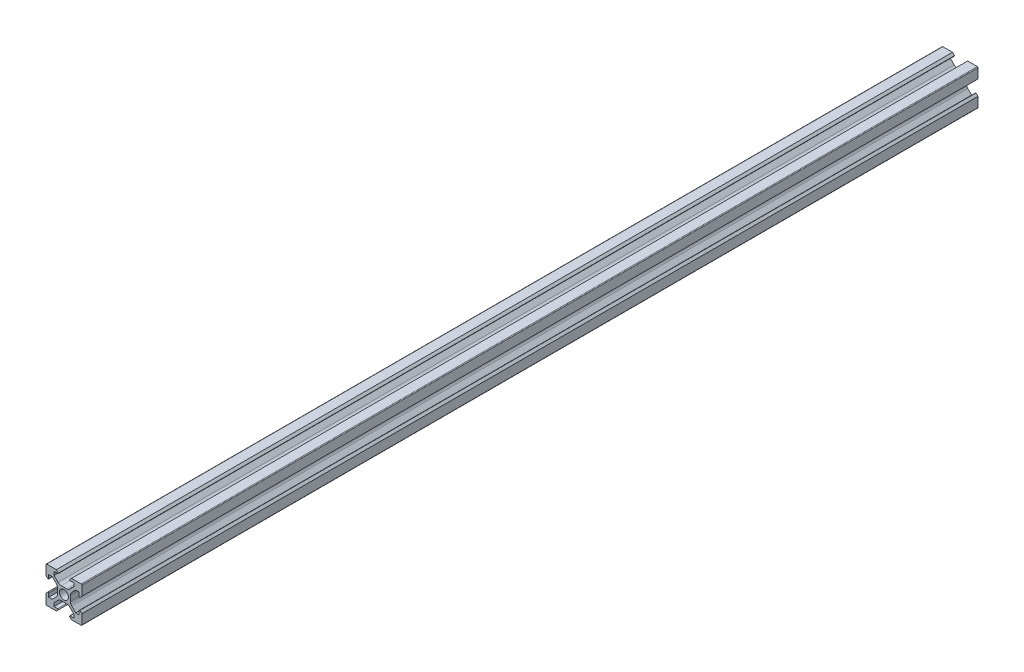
SolidWorks part; units mm, degrees
ref_plane "Plano frontal" through (0, 0, 0) normal (0, 0, 1) x (1, 0, 0)
ref_plane "Plano superior" through (0, 0, 0) normal (0, 1, 0) x (1, 0, 0)
ref_plane "Plano direito" through (0, 0, 0) normal (1, 0, 0) x (0, 0, -1)
sketch "Esboço1" plane through (0, 0, 0) normal (0, 0, 1) x (1, 0, 0)
  line L0 (-3.1, 8.9) -> (-4.2, 10)
  line L1 (-9.6, 10) -> (-4.2, 10)
  line L2 (-3.6, 1.5038) -> (-3.6, 0)
  line L3 (-8.5, 5.5) -> (-8.5, 3.5)
  line L4 (-6.5607, 5.5) -> (-4.3322, 3.2716)
  line L5 (-8.5, 5.5) -> (-6.5607, 5.5)
  line L6 (-10, 9.6) -> (-10, 4.2)
  line L7 (-8.9, 3.1) -> (-10, 4.2)
  line L8 (0, 3.6) -> (0, -3.6) construction
  line L9 (9.8828, -9.8828) -> (0, 0) construction
  line L10 (9.8828, 9.8828) -> (0, 0) construction
  line L11 (3.6, -1.5038) -> (3.6, 0)
  line L12 (8.5, -5.5) -> (8.5, -3.5)
  line L13 (-5.5, 8.5) -> (-5.5, 6.5607)
  line L14 (6.5607, -5.5) -> (4.3322, -3.2716)
  line L15 (8.5, -5.5) -> (6.5607, -5.5)
  line L16 (3.1, -8.9) -> (4.2, -10)
  line L17 (9.6, -10) -> (4.2, -10)
  line L18 (5.5, -8.5) -> (5.5, -6.5607)
  line L19 (-18.5, 8.5) -> (-18.5, -8.5) construction
  line L20 (5.5, -6.5607) -> (3.2716, -4.3322)
  line L21 (5.5, -8.5) -> (3.5, -8.5)
  line L22 (10, -9.6) -> (10, -4.2)
  line L23 (-9.8828, 9.8828) -> (0, 0) construction
  line L24 (8.9, -3.1) -> (10, -4.2)
  line L25 (-5.5, 6.5607) -> (-3.2716, 4.3322)
  line L26 (5.5, 8.5) -> (3.5, 8.5)
  line L27 (-20, 10) -> (-20, -10) construction
  line L28 (5.5, 6.5607) -> (3.2716, 4.3322)
  line L29 (5.5, 8.5) -> (5.5, 6.5607)
  line L30 (8.9, 3.1) -> (10, 4.2)
  line L31 (10, 9.6) -> (10, 4.2)
  line L32 (8.5, 5.5) -> (6.5607, 5.5)
  line L33 (-5.5, 8.5) -> (-3.5, 8.5)
  line L34 (6.5607, 5.5) -> (4.3322, 3.2716)
  line L35 (8.5, 5.5) -> (8.5, 3.5)
  line L36 (-20, 10) -> (0, 10) construction
  line L37 (3.6, 1.5038) -> (3.6, 0)
  line L38 (9.6, 10) -> (4.2, 10)
  line L39 (-18.5, 8.5) -> (-1.5, 8.5) construction
  line L40 (-1.5038, 3.6) -> (1.5038, 3.6)
  line L41 (3.1, 8.9) -> (4.2, 10)
  line L42 (-8.9, -3.1) -> (-10, -4.2)
  line L43 (-10, -9.6) -> (-10, -4.2)
  line L44 (-1.5038, -3.6) -> (1.5038, -3.6)
  line L45 (-5.5, -8.5) -> (-3.5, -8.5)
  line L46 (-5.5, -6.5607) -> (-3.2716, -4.3322)
  line L47 (-5.5, -8.5) -> (-5.5, -6.5607)
  line L48 (-9.6, -10) -> (-4.2, -10)
  line L49 (-3.1, -8.9) -> (-4.2, -10)
  line L50 (-8.5, -5.5) -> (-6.5607, -5.5)
  line L51 (-6.5607, -5.5) -> (-4.3322, -3.2716)
  line L52 (-8.5, -5.5) -> (-8.5, -3.5)
  line L53 (-3.6, -1.5038) -> (-3.6, 0)
  line L54 (0, 10) -> (0, -10) construction
  line L55 (-20, -10) -> (0, -10) construction
  line L56 (-9.8828, -9.8828) -> (0, 0) construction
  line L57 (-18.5, -8.5) -> (-1.5, -8.5) construction
  line L58 (-1.5, 8.5) -> (-1.5, -8.5) construction
  arc A0 (2.5, 0) -> (-2.5, 0) centre (0, 0) ccw
  arc A1 (-3.5, 8.5) -> (-3.1, 8.9) centre (-3.5, 8.9) ccw
  arc A2 (-9.6, 10) -> (-10, 9.6) centre (-9.6, 9.6) ccw
  arc A3 (-3.2716, 4.3322) -> (-1.5038, 3.6) centre (-1.5038, 6.1) ccw
  arc A4 (-4.3322, 3.2716) -> (-3.6, 1.5038) centre (-6.1, 1.5038) cw
  arc A5 (-8.5, 3.5) -> (-8.9, 3.1) centre (-8.9, 3.5) cw
  arc A6 (3.5, -8.5) -> (3.1, -8.9) centre (3.5, -8.9) ccw
  arc A7 (3.2716, -4.3322) -> (1.5038, -3.6) centre (1.5038, -6.1) ccw
  arc A8 (4.3322, -3.2716) -> (3.6, -1.5038) centre (6.1, -1.5038) cw
  arc A9 (10, -9.6) -> (9.6, -10) centre (9.6, -9.6) cw
  arc A10 (8.5, -3.5) -> (8.9, -3.1) centre (8.9, -3.5) cw
  arc A11 (8.5, 3.5) -> (8.9, 3.1) centre (8.9, 3.5) ccw
  arc A12 (4.3322, 3.2716) -> (3.6, 1.5038) centre (6.1, 1.5038) ccw
  arc A13 (3.2716, 4.3322) -> (1.5038, 3.6) centre (1.5038, 6.1) cw
  arc A14 (9.6, 10) -> (10, 9.6) centre (9.6, 9.6) cw
  arc A15 (3.5, 8.5) -> (3.1, 8.9) centre (3.5, 8.9) cw
  arc A16 (-2.5, 0) -> (2.5, 0) centre (0, 0) ccw
  arc A17 (-8.5, -3.5) -> (-8.9, -3.1) centre (-8.9, -3.5) ccw
  arc A18 (-10, -9.6) -> (-9.6, -10) centre (-9.6, -9.6) ccw
  arc A19 (-4.3322, -3.2716) -> (-3.6, -1.5038) centre (-6.1, -1.5038) ccw
  arc A20 (-3.2716, -4.3322) -> (-1.5038, -3.6) centre (-1.5038, -6.1) cw
  arc A21 (-3.5, -8.5) -> (-3.1, -8.9) centre (-3.5, -8.9) cw
  point P103 (0, 0)
  dimension "D1" = 45
  dimension "D3" = 20
  dimension "D2" = 0.4
extrude "Ressalto-extrusão1" add sketch "Esboço1" along normal mid plane 500
